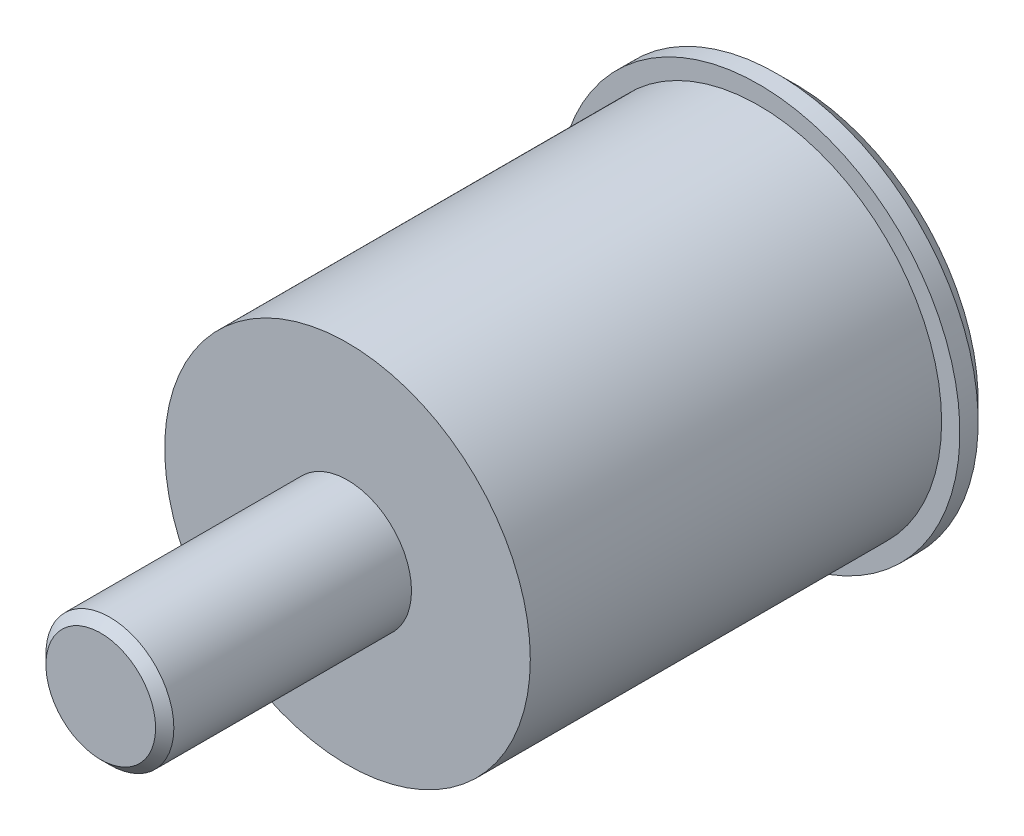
SolidWorks part; units mm, degrees
ref_plane "Face" through (0, 0, 0) normal (0, 0, 1) x (1, 0, 0)
ref_plane "Dessus" through (0, 0, 0) normal (0, 1, 0) x (1, 0, 0)
ref_plane "Droite" through (0, 0, 0) normal (1, 0, 0) x (0, 0, -1)
sketch "Esquisse1" plane through (0, 0, 0) normal (0, 0, 1) x (1, 0, 0)
  circle A0 centre (0, 0) radius 10
  dimension "D1" = 20
extrude "Base-Extrusion" add sketch "Esquisse1" against normal blind 22.5
sketch "Esquisse2" plane through (0, 0, 0) normal (0, 0, 1) x (1, 0, 0)
  circle A0 centre (0, 0) radius 3.5
  dimension "D1" = 7
extrude "Boss.-Extru.1" add sketch "Esquisse2" along normal blind 13.5
sketch "Esquisse3" plane through (0, 0, -22.5) normal (0, 0, -1) x (-1, 0, 0)
  circle A0 centre (0, 0) radius 11
  dimension "D1" = 22
extrude "Boss.-Extru.2" add sketch "Esquisse3" along normal blind 2
chamfer "Chanfrein1" distance 1 angle 45
sketch "Esquisse4" plane through (0, 0, -24.5) normal (0, 0, -1) x (-1, 0, 0)
  line L1 (-4.5, 1) -> (4.5, 1)
  line L2 (-4.5, 1) -> (-4.5, -1)
  line L3 (-4.5, -1) -> (4.5, -1)
  line L4 (4.5, 1) -> (4.5, -1)
  dimension "D1" = 2
  dimension "D2" = 1
  dimension "D3" = 9
  dimension "D4" = 4.5
extrude "Enlèv. mat.-Extru.1" cut sketch "Esquisse4" against normal blind 20
chamfer "Chanfrein2" distance 0.5 angle 45
